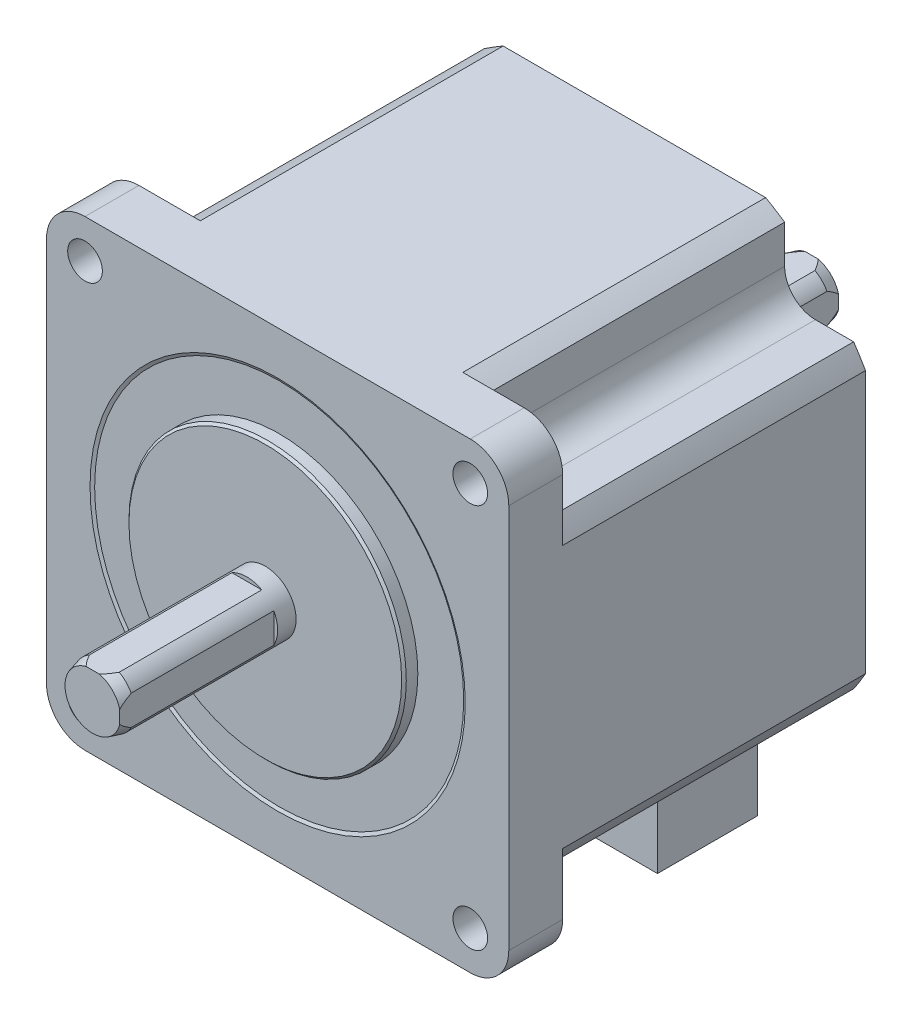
SolidWorks part; units mm, degrees
ref_plane "正面" through (0, 0, 0) normal (0, 0, 1) x (1, 0, 0)
ref_plane "平面" through (0, 0, 0) normal (0, 1, 0) x (1, 0, 0)
ref_plane "右側面" through (0, 0, 0) normal (1, 0, 0) x (0, 0, -1)
sketch "ｽｹｯﾁ1" plane through (0, 0, 0) normal (0, 0, 1) x (1, 0, 0)
  circle A0 centre (0, 0) radius 4
  dimension "D1" = 8
extrude "押し出し1" add sketch "ｽｹｯﾁ1" along normal blind 22.4
sketch "ｽｹｯﾁ2" plane through (0, 0, 0) normal (0, 0, -1) x (-1, 0, 0)
  circle A0 centre (0, 0) radius 18
  dimension "D1" = 36
extrude "押し出し2" add sketch "ｽｹｯﾁ2" along normal blind 1.6
sketch "ｽｹｯﾁ3" plane through (0, 0, -1.6) normal (0, 0, -1) x (-1, 0, 0)
  line L1 (-30, 30) -> (30, 30)
  line L2 (-30, 30) -> (-30, -30)
  line L3 (-30, -30) -> (30, -30)
  line L4 (30, 30) -> (30, -30)
  line L5 (-30, 30) -> (30, -30) construction
  line L6 (-30, -30) -> (30, 30) construction
  line L7 (25, 25) -> (-25, 25) construction
  line L8 (25, 25) -> (25, -25) construction
  line L9 (25, -25) -> (-25, -25) construction
  line L10 (-25, 25) -> (-25, -25) construction
  line L11 (25, 25) -> (-25, -25) construction
  line L12 (25, -25) -> (-25, 25) construction
  circle A0 centre (25, 25) radius 2.25
  circle A1 centre (-25, 25) radius 2.25
  circle A2 centre (25, -25) radius 2.25
  circle A3 centre (-25, -25) radius 2.25
  point P0 (0, 0)
  point P6 (0, 0)
  dimension "D3" = 50
  dimension "D4" = 50
  dimension "D6" = 4.5
  dimension "D1" = 60
  dimension "D2" = 60
extrude "押し出し3" add sketch "ｽｹｯﾁ3" along normal blind 7
fillet "Fillet1" radius 5 4 edges at (30, -30, -5.1) (-30, -30, -5.1) (-30, 30, -5.1) (30, 30, -5.1)
sketch "ｽｹｯﾁ4" plane through (0, 0, -8.6) normal (0, 0, -1) x (-1, 0, 0)
  line L0 (19.5, 19.5) -> (30, 19.5)
  line L1 (-19.5, 30) -> (19.5, 30)
  line L2 (-19.5, 30) -> (-19.5, 19.5)
  line L3 (-19.5, -30) -> (19.5, -30)
  line L4 (19.5, 30) -> (19.5, 19.5)
  line L5 (-19.5, 30) -> (19.5, -30) construction
  line L6 (-19.5, -30) -> (19.5, 30) construction
  line L7 (-30, 19.5) -> (-19.5, 19.5)
  line L8 (-30, 19.5) -> (-30, -19.5)
  line L9 (-30, -19.5) -> (-19.5, -19.5)
  line L10 (30, 19.5) -> (30, -19.5)
  line L11 (-30, 19.5) -> (30, -19.5) construction
  line L12 (-30, -19.5) -> (30, 19.5) construction
  line L13 (-19.5, -19.5) -> (-19.5, -30)
  line L14 (19.5, -19.5) -> (30, -19.5)
  line L15 (19.5, -19.5) -> (19.5, -30)
  circle A0 centre (0, 0) radius 34.5
  point P0 (0, 0)
  point P6 (0, 0)
  dimension "D5" = 69
  dimension "D1" = 39
  dimension "D2" = 60
  dimension "D3" = 60
  dimension "D4" = 39
extrude "押し出し4" add sketch "ｽｹｯﾁ4" along normal blind 39.3 contours L10 A0 L0 L4 L1 L2 L7 L8 L9 L13 L3 L15 L14
fillet "Fillet2" radius 4 4 edges at (19.5, -19.5, -28.25) (-19.5, -19.5, -28.25) (-19.5, 19.5, -28.25) (19.5, 19.5, -28.25)
sketch "Sketch1" plane through (0, -30, 0) normal (0, -1, 0) x (1, 0, 0)
  line L0 (17.0367, -47.9) -> (-17.0367, -47.9) construction
  line L1 (-16, -47.9) -> (16, -47.9)
  line L2 (-16, -47.9) -> (-16, -34.9)
  line L3 (-16, -34.9) -> (16, -34.9)
  line L4 (16, -47.9) -> (16, -34.9)
  dimension "D1" = 13
  dimension "D2" = 32
  dimension "D3" = 16
extrude "Extrude1" add sketch "Sketch1" along normal blind 10
chamfer "Chamfer1" distance 1.5 angle 15 1 edges at (4, 0, 22.4)
sketch "Sketch2" plane through (0, 0, 22.4) normal (0, 0, 1) x (1, 0, 0)
  line L1 (-4.7278, 5.1185) -> (3.4221, 5.1185)
  line L2 (-4.7278, 5.1185) -> (-4.7278, 3.5)
  line L3 (-4.7278, 3.5) -> (3.4221, 3.5)
  line L4 (3.4221, 5.1185) -> (3.4221, 3.5)
  line L5 (5.2412, 2.4413) -> (3.5, 2.4413)
  line L6 (5.2412, 2.4413) -> (5.2412, -4.2883)
  line L7 (5.2412, -4.2883) -> (3.5, -4.2883)
  line L8 (3.5, 2.4413) -> (3.5, -4.2883)
  dimension "D1" = 3.5
  dimension "D2" = 3.5
extrude "Extrude2" cut sketch "Sketch2" against normal blind 20
chamfer "Chamfer2" distance 0.3 angle 45 1 edges at (-18, 0, 0)
sketch "Sketch3" plane through (0, 0, -1.6) normal (0, 0, 1) x (1, 0, 0)
  circle A0 centre (0, 0) radius 18
  circle A1 centre (0, 0) radius 24.35
  dimension "D1" = 48.7
  dimension "D2" = 36
extrude "Extrude3" cut sketch "Sketch3" against normal blind 0.2
chamfer "Chamfer3" distance 0.2 distance2 0.4 1 edges at (24.35, 0, -1.8)
sketch "Sketch4" plane through (0, 0, -47.9) normal (0, 0, -1) x (-1, 0, 0)
  circle A0 centre (0, 0) radius 4
  dimension "D1" = 8
extrude "Extrude4" add sketch "Sketch4" along normal blind 23
sketch "Sketch5" plane through (0, 0, -70.9) normal (0, 0, -1) x (-1, 0, 0)
  line L1 (-2.9986, 5.5143) -> (3.3195, 5.5143)
  line L2 (-2.9986, 5.5143) -> (-2.9986, 3.5)
  line L3 (-2.9986, 3.5) -> (3.3195, 3.5)
  line L4 (3.3195, 5.5143) -> (3.3195, 3.5)
  line L5 (-5.554, 2.808) -> (-3.5, 2.808)
  line L6 (-5.554, 2.808) -> (-5.554, -3.231)
  line L7 (-5.554, -3.231) -> (-3.5, -3.231)
  line L8 (-3.5, 2.808) -> (-3.5, -3.231)
  dimension "D1" = 3.5
  dimension "D2" = 3.5
extrude "Extrude5" cut sketch "Sketch5" against normal blind 20
chamfer "Chamfer4" distance 1.5 angle 15 2 edges at (-2.8284, -2.8284, -70.9) (2.8284, 2.8284, -70.9)
